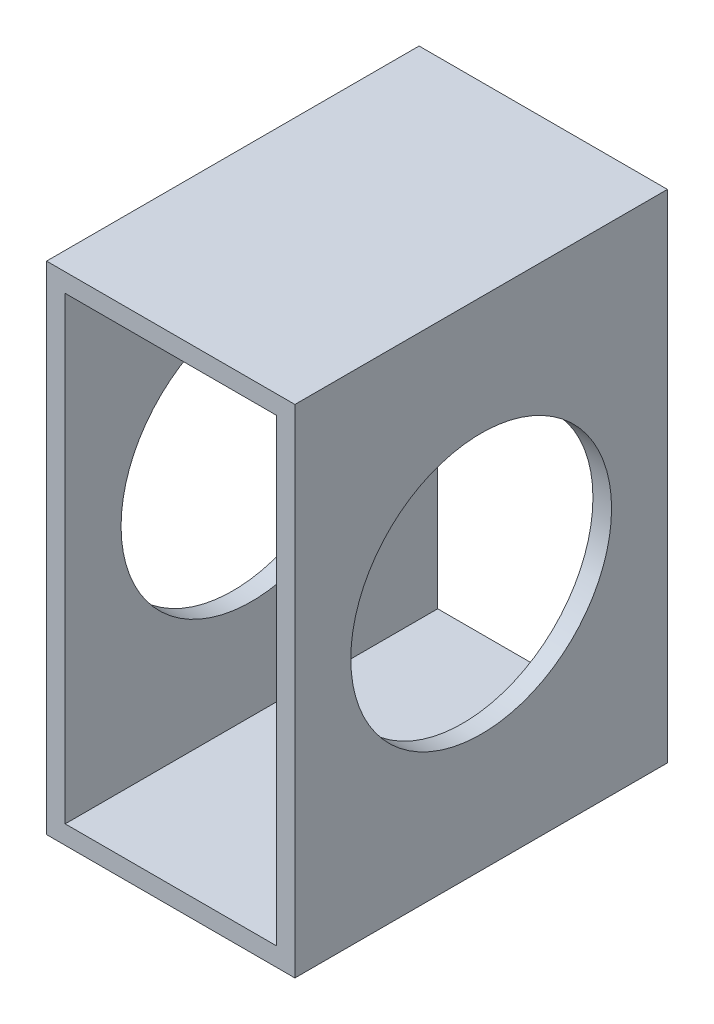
SolidWorks part; units mm, degrees
ref_plane "Front" through (0, 0, 0) normal (0, 0, 1) x (1, 0, 0)
ref_plane "Top" through (0, 0, 0) normal (0, 1, 0) x (1, 0, 0)
ref_plane "Right" through (0, 0, 0) normal (1, 0, 0) x (0, 0, -1)
sketch "Schizzo1" plane through (0, 0, 0) normal (0, 0, 1) x (1, 0, 0)
  line L1 (20, -40) -> (-20, -40)
  line L2 (20, -40) -> (20, 40)
  line L3 (20, 40) -> (-20, 40)
  line L4 (-20, -40) -> (-20, 40)
  line L5 (20, -40) -> (-20, 40) construction
  line L6 (20, 40) -> (-20, -40) construction
  line L7 (17, -37) -> (-17, -37)
  line L8 (17, -37) -> (17, 37)
  line L9 (17, 37) -> (-17, 37)
  line L10 (-17, -37) -> (-17, 37)
  line L11 (17, -37) -> (-17, 37) construction
  line L12 (17, 37) -> (-17, -37) construction
  point P0 (0, 0)
  point P6 (0, 0)
  dimension "D1" = 40
  dimension "D2" = 80
  dimension "D3" = 3
  dimension "D4" = 3
extrude "Estrusione-Estrusione1" add sketch "Schizzo1" along normal mid plane 60
sketch "Schizzo2" plane through (20, 0, 0) normal (1, 0, 0) x (0, 0, -1)
  circle A0 centre (0, 0) radius 21
  dimension "D1" = 42
extrude "Taglio-Estrusione1" cut sketch "Schizzo2" against normal up to surface (40 mm away)
